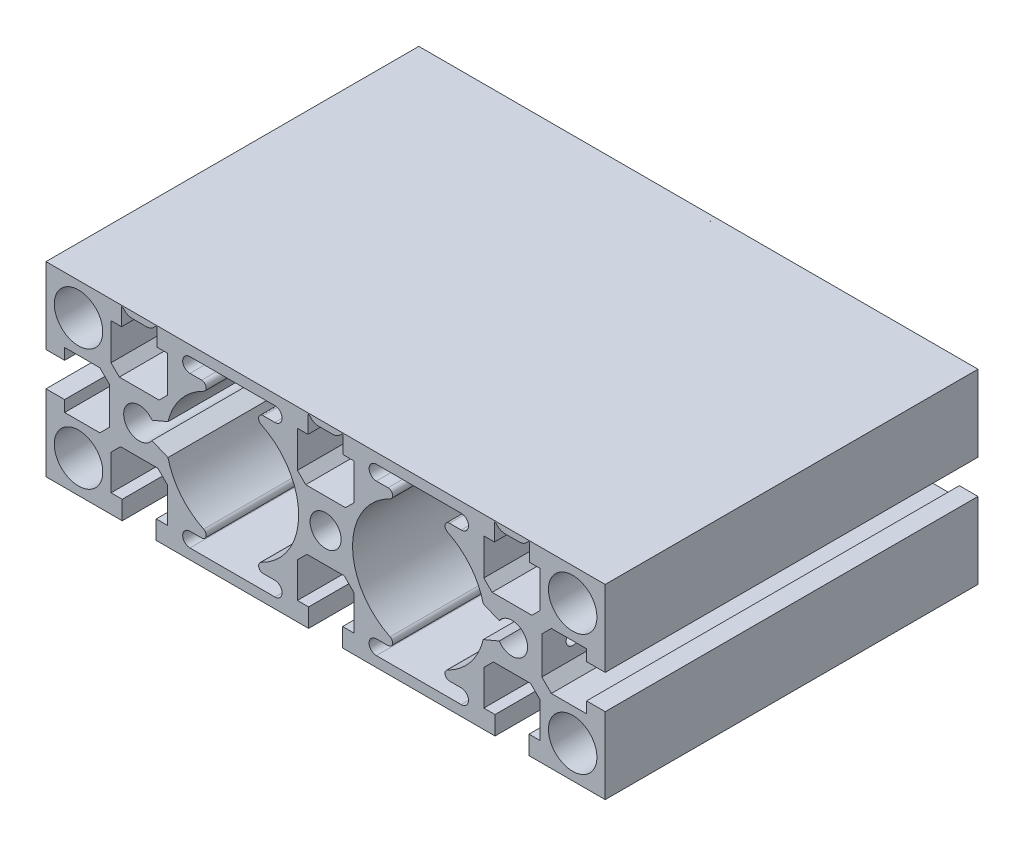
SolidWorks part; units mm, degrees
ref_plane "Front Plane" through (0, 0, 0) normal (0, 0, 1) x (1, 0, 0)
ref_plane "Top Plane" through (0, 0, 0) normal (0, 1, 0) x (1, 0, 0)
ref_plane "Right Plane" through (0, 0, 0) normal (1, 0, 0) x (0, 0, -1)
sketch "Sketch1" plane through (0, 0, 0) normal (0, 0, 1) x (1, 0, 0)
  line L8 (-38.0543, -3.75) -> (-41.9102, -2.125)
  line L9 (-32.75, -16.5) -> (-29.9226, -16.5)
  line L10 (-12.25, -20) -> (-32.75, -20)
  line L11 (-15.0774, -16.5) -> (-12.25, -16.5)
  line L12 (-12.25, 16.5) -> (-15.0774, 16.5)
  line L13 (-32.75, 20) -> (-12.25, 20)
  line L14 (-29.9226, 16.5) -> (-32.75, 16.5)
  line L15 (-41.9102, 2.125) -> (-38.0543, 3.75)
  line L24 (12.25, -16.5) -> (15.0774, -16.5)
  line L25 (32.75, -20) -> (12.25, -20)
  line L26 (29.9226, -16.5) -> (32.75, -16.5)
  line L27 (41.9102, -2.125) -> (38.0543, -3.75)
  line L28 (38.0543, 3.75) -> (41.9102, 2.125)
  line L29 (32.75, 16.5) -> (29.9226, 16.5)
  line L30 (12.25, 20) -> (32.75, 20)
  line L31 (15.0774, 16.5) -> (12.25, 16.5)
  line L46 (41.05, 22.2) -> (41.5178, 21.7322)
  line L47 (40.75, 22.2) -> (41.05, 22.2)
  line L48 (40.75, 18) -> (40.75, 22.2)
  line L49 (38.2, 18) -> (40.75, 18)
  line L50 (38.2, 9.2) -> (38.2, 18)
  line L51 (40.2, 7.2) -> (38.2, 9.2)
  line L52 (49.8, 7.2) -> (40.2, 7.2)
  line L53 (51.8, 9.2) -> (49.8, 7.2)
  line L108 (63, 4.1) -> (67.5, 4.1)
  line L109 (67.5, 4.1) -> (67.5, 22.5)
  line L110 (67.5, 22.5) -> (-67.5, 22.5)
  line L111 (-67.5, 22.5) -> (-67.5, 4.1)
  line L112 (-67.5, 4.1) -> (-63, 4.1)
  line L113 (-63, 4.1) -> (-63, 6.8)
  line L114 (-63, 6.8) -> (-54.5, 6.8)
  line L115 (-54.5, 6.8) -> (-52.2, 4.5)
  line L116 (-52.2, 4.5) -> (-52.2, -4.5)
  line L117 (-52.2, -4.5) -> (-54.5, -6.8)
  line L118 (-54.5, -6.8) -> (-63, -6.8)
  line L119 (-63, -6.8) -> (-63, -4.1)
  line L120 (-63, -4.1) -> (-67.5, -4.1)
  line L121 (-67.5, -4.1) -> (-67.5, -22.5)
  line L122 (-67.5, -22.5) -> (-49.1, -22.5)
  line L123 (-49.1, -22.5) -> (-49.1, -18)
  line L124 (-49.1, -18) -> (-51.8, -18)
  line L125 (-51.8, -18) -> (-51.8, -9.5)
  line L126 (-51.8, -9.5) -> (-49.5, -7.2)
  line L127 (-49.5, -7.2) -> (-40.5, -7.2)
  line L128 (-40.5, -7.2) -> (-38.2, -9.5)
  line L129 (-38.2, -9.5) -> (-38.2, -18)
  line L130 (-38.2, -18) -> (-40.9, -18)
  line L131 (-40.9, -18) -> (-40.9, -22.5)
  line L132 (-40.9, -22.5) -> (-4.1, -22.5)
  line L133 (-4.1, -22.5) -> (-4.1, -18)
  line L134 (-4.1, -18) -> (-6.8, -18)
  line L135 (-6.8, -18) -> (-6.8, -9.5)
  line L136 (-6.8, -9.5) -> (-4.5, -7.2)
  line L137 (-4.5, -7.2) -> (4.5, -7.2)
  line L138 (4.5, -7.2) -> (6.8, -9.5)
  line L139 (6.8, -9.5) -> (6.8, -18)
  line L140 (6.8, -18) -> (4.1, -18)
  line L141 (4.1, -18) -> (4.1, -22.5)
  line L142 (4.1, -22.5) -> (40.9, -22.5)
  line L143 (40.9, -22.5) -> (40.9, -18)
  line L144 (40.9, -18) -> (38.2, -18)
  line L145 (38.2, -18) -> (38.2, -9.5)
  line L146 (38.2, -9.5) -> (40.5, -7.2)
  line L147 (40.5, -7.2) -> (49.5, -7.2)
  line L148 (49.5, -7.2) -> (51.8, -9.5)
  line L149 (51.8, -9.5) -> (51.8, -18)
  line L150 (51.8, -18) -> (49.1, -18)
  line L151 (49.1, -18) -> (49.1, -22.5)
  line L152 (49.1, -22.5) -> (67.5, -22.5)
  line L153 (67.5, -22.5) -> (67.5, -4.1)
  line L154 (67.5, -4.1) -> (63, -4.1)
  line L155 (63, -4.1) -> (63, -6.8)
  line L156 (63, -6.8) -> (54.5, -6.8)
  line L157 (54.5, -6.8) -> (52.2, -4.5)
  line L158 (52.2, -4.5) -> (52.2, 4.5)
  line L159 (52.2, 4.5) -> (54.5, 6.8)
  line L160 (54.5, 6.8) -> (63, 6.8)
  line L161 (63, 6.8) -> (63, 4.1)
  line L162 (51.8, 18) -> (51.8, 9.2)
  line L163 (49.25, 22.2) -> (49.25, 18)
  line L164 (49.25, 18) -> (51.8, 18)
  line L165 (48.95, 22.2) -> (49.25, 22.2)
  line L166 (48.4823, 21.7323) -> (48.95, 22.2)
  line L167 (43.2856, 21) -> (46.7145, 21)
  line L182 (-3.95, 22.2) -> (-3.4822, 21.7322)
  line L183 (-4.25, 22.2) -> (-3.95, 22.2)
  line L184 (-4.25, 18) -> (-4.25, 22.2)
  line L185 (-6.8, 18) -> (-4.25, 18)
  line L186 (-6.8, 9.2) -> (-6.8, 18)
  line L187 (-4.8, 7.2) -> (-6.8, 9.2)
  line L188 (4.8, 7.2) -> (-4.8, 7.2)
  line L189 (6.8, 9.2) -> (4.8, 7.2)
  line L190 (6.8, 18) -> (6.8, 9.2)
  line L191 (4.25, 18) -> (6.8, 18)
  line L192 (4.25, 22.2) -> (4.25, 18)
  line L193 (3.95, 22.2) -> (4.25, 22.2)
  line L194 (3.4823, 21.7323) -> (3.95, 22.2)
  line L195 (-1.7144, 21) -> (1.7145, 21)
  line L210 (-49.8, 7.2) -> (-51.8, 9.2)
  line L211 (-40.2, 7.2) -> (-49.8, 7.2)
  line L212 (-38.2, 9.2) -> (-40.2, 7.2)
  line L213 (-38.2, 18) -> (-38.2, 9.2)
  line L214 (-40.75, 18) -> (-38.2, 18)
  line L215 (-40.75, 22.2) -> (-40.75, 18)
  line L216 (-41.05, 22.2) -> (-40.75, 22.2)
  line L217 (-41.5177, 21.7323) -> (-41.05, 22.2)
  line L218 (-46.7144, 21) -> (-43.2855, 21)
  line L219 (-48.95, 22.2) -> (-48.4822, 21.7322)
  line L220 (-49.25, 22.2) -> (-48.95, 22.2)
  line L221 (-49.25, 18) -> (-49.25, 22.2)
  line L222 (-51.8, 18) -> (-49.25, 18)
  line L223 (-51.8, 9.2) -> (-51.8, 18)
  circle A4 centre (59.65, 14.65) radius 5.85
  circle A5 centre (59.65, -14.65) radius 5.85
  circle A6 centre (-59.65, -14.65) radius 5.85
  circle A7 centre (-59.65, 14.65) radius 5.85
  arc A20 (-38.0543, -3.75) -> (-29.4461, -14.4136) centre (-22.5, 0) ccw
  arc A21 (-29.9226, -16.5) -> (-29.4461, -14.4136) centre (-29.9226, -15.4024) ccw
  arc A22 (-32.75, -16.5) -> (-32.75, -20) centre (-32.75, -18.25) ccw
  arc A23 (-12.25, -20) -> (-12.25, -16.5) centre (-12.25, -18.25) ccw
  arc A24 (-15.5539, -14.4136) -> (-15.0774, -16.5) centre (-15.0774, -15.4024) ccw
  arc A25 (-15.5539, -14.4136) -> (-15.5539, 14.4136) centre (-22.5, 0) ccw
  arc A26 (-15.0774, 16.5) -> (-15.5539, 14.4136) centre (-15.0774, 15.4024) ccw
  arc A27 (-12.25, 16.5) -> (-12.25, 20) centre (-12.25, 18.25) ccw
  arc A28 (-32.75, 20) -> (-32.75, 16.5) centre (-32.75, 18.25) ccw
  arc A29 (-29.4461, 14.4136) -> (-29.9226, 16.5) centre (-29.9226, 15.4024) ccw
  arc A30 (-29.4461, 14.4136) -> (-38.0543, 3.75) centre (-22.5, 0) ccw
  arc A31 (-41.9102, 2.125) -> (-41.9102, -2.125) centre (-45, 0) ccw
  arc A44 (15.0774, -16.5) -> (15.5539, -14.4136) centre (15.0774, -15.4024) ccw
  arc A45 (12.25, -16.5) -> (12.25, -20) centre (12.25, -18.25) ccw
  arc A46 (32.75, -20) -> (32.75, -16.5) centre (32.75, -18.25) ccw
  arc A47 (29.4461, -14.4136) -> (29.9226, -16.5) centre (29.9226, -15.4024) ccw
  arc A48 (29.4461, -14.4136) -> (38.0543, -3.75) centre (22.5, 0) ccw
  arc A49 (41.9102, -2.125) -> (41.9102, 2.125) centre (45, 0) ccw
  arc A50 (38.0543, 3.75) -> (29.4461, 14.4136) centre (22.5, 0) ccw
  arc A51 (29.9226, 16.5) -> (29.4461, 14.4136) centre (29.9226, 15.4024) ccw
  arc A52 (32.75, 16.5) -> (32.75, 20) centre (32.75, 18.25) ccw
  arc A53 (12.25, 20) -> (12.25, 16.5) centre (12.25, 18.25) ccw
  arc A54 (15.5539, 14.4136) -> (15.0774, 16.5) centre (15.0774, 15.4024) ccw
  arc A55 (15.5539, 14.4136) -> (15.5539, -14.4136) centre (22.5, 0) ccw
  arc A58 (41.5178, 21.7322) -> (43.2856, 21) centre (43.2856, 23.5) ccw
  arc A59 (46.7145, 21) -> (48.4823, 21.7323) centre (46.7145, 23.5) ccw
  arc A62 (-3.4822, 21.7322) -> (-1.7144, 21) centre (-1.7144, 23.5) ccw
  arc A63 (1.7145, 21) -> (3.4823, 21.7323) centre (1.7145, 23.5) ccw
  arc A66 (-43.2855, 21) -> (-41.5177, 21.7323) centre (-43.2855, 23.5) ccw
  arc A67 (-48.4822, 21.7322) -> (-46.7144, 21) centre (-46.7144, 23.5) ccw
  circle A69 centre (0, 0) radius 3.75
  dimension "D1" = 135
extrude "Extrude1" add sketch "Sketch1" along normal blind 90
sketch "Sketch2" plane through (67.5, 0, 0) normal (1, 0, 0) x (0, 0, -1)
  line L0 (-90, 22.5) -> (0, 22.5) construction
  line L1 (-90, 4.1) -> (-90, 22.5) construction
  line L2 (0, 4.1) -> (0, 22.5) construction
  point P0 (-82.5, 0)
  point P1 (-7.5, 0)
  dimension "D1" = 22.5
  dimension "D2" = 22.5
  dimension "D3" = 7.5
  dimension "D4" = 7.5
hole_wizard "M4 Tapped Hole1" positions "3DSketch1" profile "Sketch3" tap size "M4" standard "ISO"
sketch3d "3DSketch1"
  point P0 (67.5, 0, 82.5)
  point P3 (67.5, 0, 7.5)
sketch "Sketch3" plane through (67.5, 0, 82.5) normal (0, 0, 1) x (0, 1, 0)
  line L0 (0, 0) -> (0, 45.4414)
  line L1 (0, 45.4414) -> (1.65, 44.45)
  line L2 (1.65, 44.45) -> (1.65, 0)
  line L5 (1.65, 0) -> (0, 0)
  line L10 (0, 45.4414) -> (-1.65, 44.45) construction
  line L11 (0, -6.35) -> (0, 107.95) construction
  dimension "Tap Drill Dia." = 3.3
  dimension "Tap Drill Depth" = 44.45
  dimension "Drill Angle" = 118
mirror "Mirror1" about plane through (0, 0, 0) normal (1, 0, 0) of "M4 Tapped Hole1"
